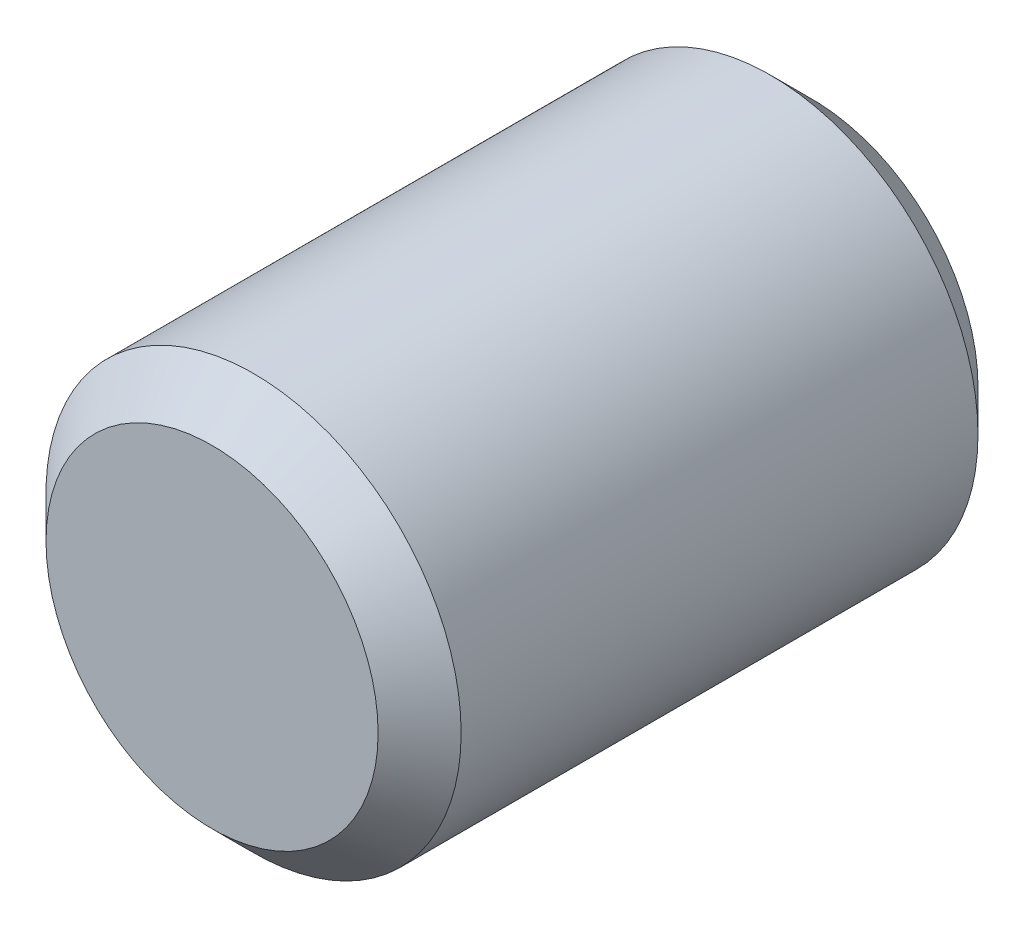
SolidWorks part; units mm, degrees
ref_plane "Face" through (0, 0, 0) normal (0, 0, 1) x (1, 0, 0)
ref_plane "Dessus" through (0, 0, 0) normal (0, 1, 0) x (1, 0, 0)
ref_plane "Droite" through (0, 0, 0) normal (1, 0, 0) x (0, 0, -1)
sketch "Esquisse1" plane through (0, 0, 0) normal (0, 0, 1) x (1, 0, 0)
  circle A0 centre (0, 0) radius 5
  dimension "D1" = 10
extrude "Base-Extrusion" add sketch "Esquisse1" along normal blind 14.45
chamfer "Chanfrein1" distance 1 angle 45
